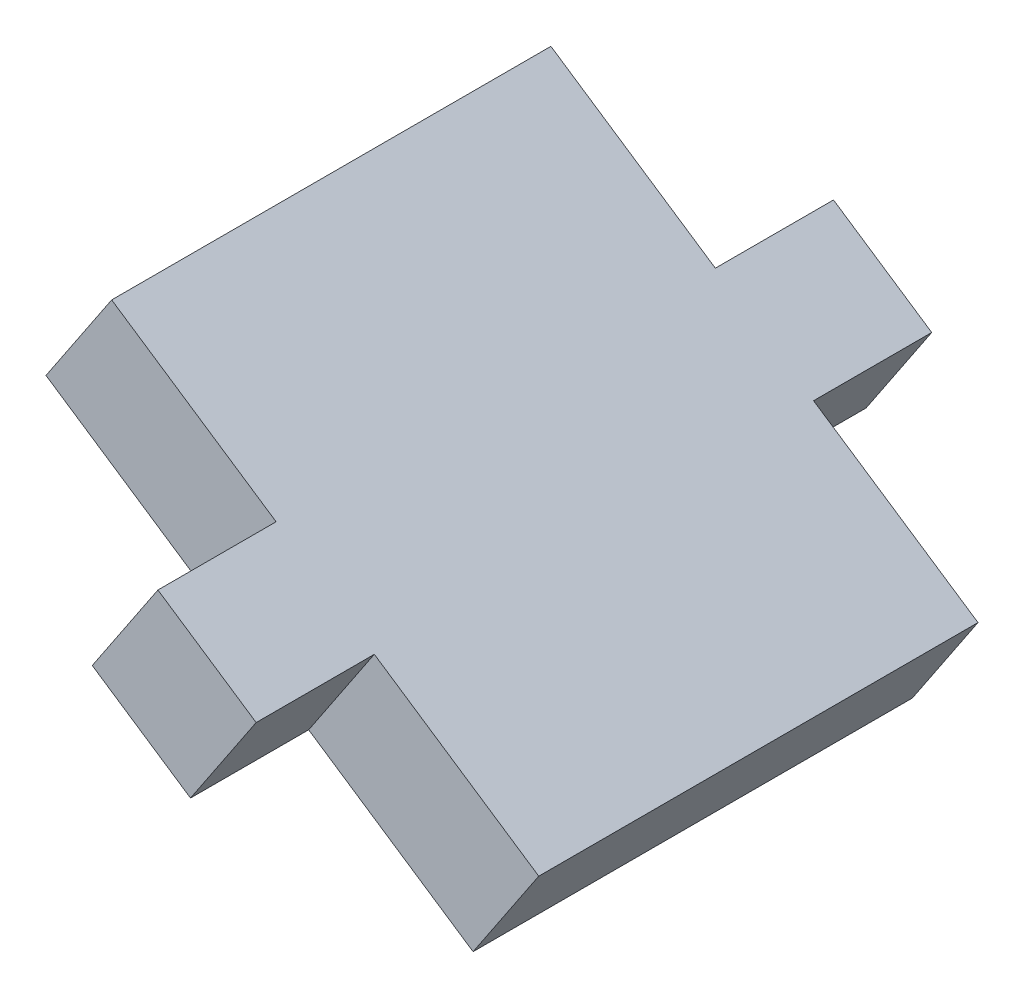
SolidWorks part; units mm, degrees
ref_plane "Front Plane" through (0, 0, 0) normal (0, 0, 1) x (1, 0, 0)
ref_plane "Top Plane" through (0, 0, 0) normal (0, 1, 0) x (1, 0, 0)
ref_plane "Right Plane" through (0, 0, 0) normal (1, 0, 0) x (0, 0, -1)
sketch "Sketch1" plane through (0, 0, 0) normal (0, 0, 1) x (1, 0, 0)
  line L0 (-753.455, 320.5742) -> (-733.9933, 307.5644)
  line L1 (-756.4475, 316.0976) -> (-733.9933, 301.0873) construction
  line L3 (-753.455, 320.5742) -> (-731.0007, 305.5639) construction
  line L4 (-756.4475, 316.0976) -> (-753.455, 320.5742)
  line L5 (-733.9933, 307.5644) -> (-736.9859, 303.0878)
  line L31 (-756.4475, 316.0976) -> (-736.9859, 303.0878)
  dimension "D1" = 5.3848
extrude "Boss-Extrude1" add sketch "Sketch1" against normal blind 20.0152 contours L31 L5 L0 L4
sketch "Sketch2" plane through (0, 0, 0) normal (0, 0, 1) x (1, 0, 0)
  line L5 (-756.4475, 316.0976) -> (-736.9859, 303.0878) construction
  line L7 (-748.9551, 311.089) -> (-744.4784, 308.0964)
  line L8 (-748.9551, 311.089) -> (-745.9625, 315.5656)
  line L9 (-744.4784, 308.0964) -> (-741.4858, 312.5731)
  line L10 (-741.4858, 312.5731) -> (-745.9625, 315.5656)
  dimension "D3" = 5.3848
extrude "Boss-Extrude2" add sketch "Sketch2" along normal blind 5.3848
sketch "Sketch3" plane through (0, 0, -20.0152) normal (0, 0, -1) x (-1, 0, 0)
  line L2 (753.455, 320.5742) -> (733.9933, 307.5644) construction
  line L3 (741.4858, 312.5731) -> (744.4784, 308.0964)
  line L4 (756.4475, 316.0976) -> (736.9859, 303.0878) construction
  line L5 (744.4784, 308.0964) -> (748.9551, 311.089)
  line L6 (748.9551, 311.089) -> (745.9625, 315.5656)
  line L7 (745.9625, 315.5656) -> (741.4858, 312.5731)
  dimension "D1" = 5.3848
extrude "Boss-Extrude3" add sketch "Sketch3" along normal blind 5.3848
